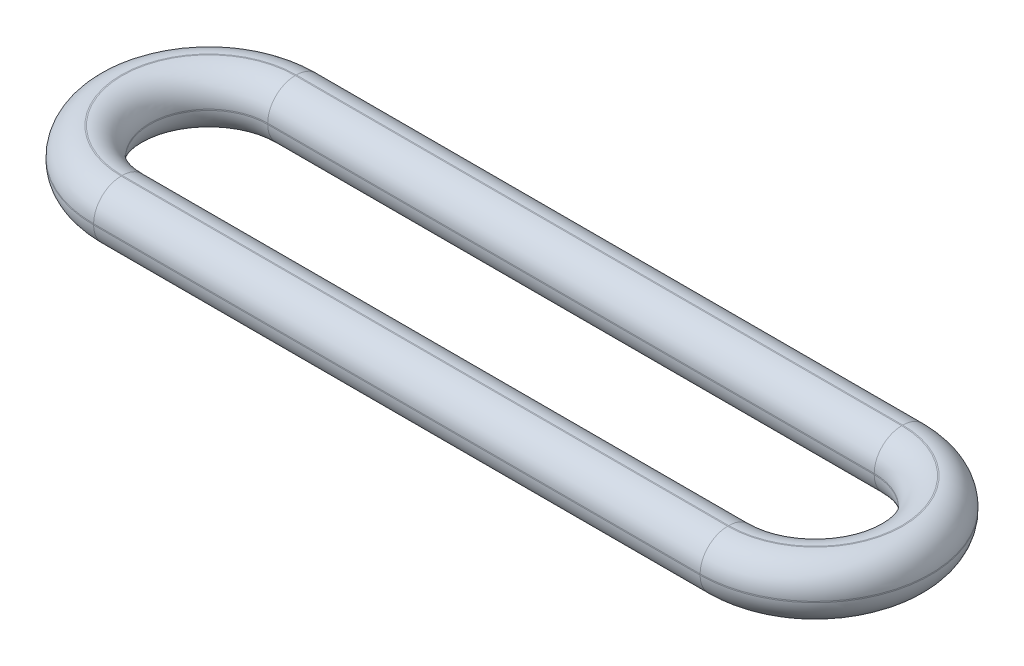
SolidWorks part; units mm, degrees
ref_plane "Front Plane" through (0, 0, 0) normal (0, 0, 1) x (1, 0, 0)
ref_plane "Top Plane" through (0, 0, 0) normal (0, 1, 0) x (1, 0, 0)
ref_plane "Right Plane" through (0, 0, 0) normal (1, 0, 0) x (0, 0, -1)
sketch "Sketch1" plane through (0, 0, 0) normal (0, 1, 0) x (1, 0, 0)
  line L0 (0, 1.05) -> (10.8, 1.05)
  line L1 (0, -0.55) -> (0, 0.55) construction
  line L2 (10.8, -1.05) -> (0, -1.05)
  line L3 (-0.55, 0) -> (0.55, 0) construction
  line L4 (0, 2.05) -> (10.8, 2.05)
  line L5 (10.8, -2.05) -> (0, -2.05)
  arc A0 (10.8, 1.05) -> (10.8, -1.05) centre (10.8, 0) cw
  arc A1 (0, 1.05) -> (0, -1.05) centre (0, 0) ccw
  arc A2 (10.8, 2.05) -> (10.8, -2.05) centre (10.8, 0) cw
  arc A3 (0, 2.05) -> (0, -2.05) centre (0, 0) ccw
  dimension "D1" = 2.1
  dimension "D2" = 10.8
  dimension "D3" = 1
extrude "Boss-Extrude1" add sketch "Sketch1" along normal blind 1
fillet "Fillet1" radius 0.49 16 edges at (-1.05, 0, 0) (5.4, 0, -1.05) (11.85, 0, 0) (5.4, 0, 1.05) (11.85, 1, 0) (5.4, 1, -1.05) (-1.05, 1, 0) (5.4, 1, 1.05) (5.4, 1, -2.05) (12.85, 1, 0) (5.4, 1, 2.05) (-2.05, 1, 0) (5.4, 0, 2.05) (-2.05, 0, 0) (5.4, 0, -2.05) (12.85, 0, 0)
